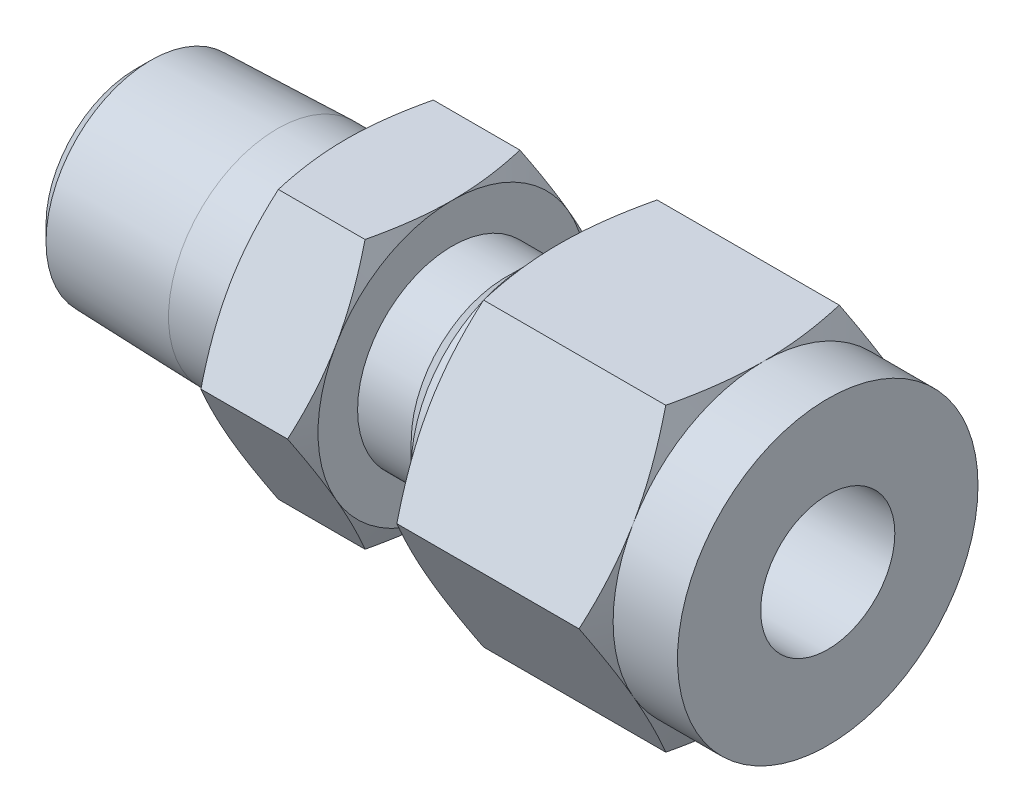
SolidWorks part; units mm, degrees
ref_plane "Front Plane" through (0, 0, 0) normal (0, 0, 1) x (1, 0, 0)
ref_plane "Top Plane" through (0, 0, 0) normal (0, 1, 0) x (1, 0, 0)
ref_plane "Right Plane" through (0, 0, 0) normal (1, 0, 0) x (0, 0, -1)
imported_body "Imported3"
sketch "Sketch1" plane through (29.718, 0, 0) normal (1, 0, 0) x (0, 0, -1)
  circle A0 centre (0, 0) radius 7.112
extrude "Boss-Extrude1" add sketch "Sketch1" along normal blind 3.048
sketch "Sketch2" plane through (9.967, 0, 0) normal (-1, 0, 0) x (0, 0, 1)
  circle A0 centre (0, 0) radius 5.1435
extrude "Boss-Extrude2" add sketch "Sketch2" along normal blind 3.2639
sketch "Sketch3" plane through (6.7031, 0, 0) normal (-1, 0, 0) x (0, 0, 1)
  circle A0 centre (0, 0) radius 5.1435
extrude "Boss-Extrude3" add sketch "Sketch3" along normal blind 6.7031 draft 1.783
hole_wizard "Hole1" positions "Sketch5" profile "Sketch4" legacy
sketch "Sketch5" plane through (32.766, 0, 0) normal (1, 0, 0) x (0, 0, -1)
  point P0 (0, 0)
sketch "Sketch4" plane through (32.766, 0, 0) normal (0, 1, 0) x (0, 0, -1)
  line L0 (0, 0) -> (0, 32.766)
  line L1 (0, 32.766) -> (2.413, 32.766)
  line L2 (2.413, 32.766) -> (2.413, 15.24)
  line L3 (2.413, 15.24) -> (3.175, 15.24)
  line L4 (3.175, 15.24) -> (3.175, 0)
  line L5 (3.175, 0) -> (0, 0)
  line L6 (0, 110) -> (0, -10) construction
  dimension "Diameter" = 4.826
  dimension "Depth" = 32.766
  dimension "C-Bore Diameter" = 6.35
  dimension "C-Bore Depth" = 15.24
chamfer "Chamfer1" distance 0.6943 angle 45 1 edges at (0, -4.9348, 0)
